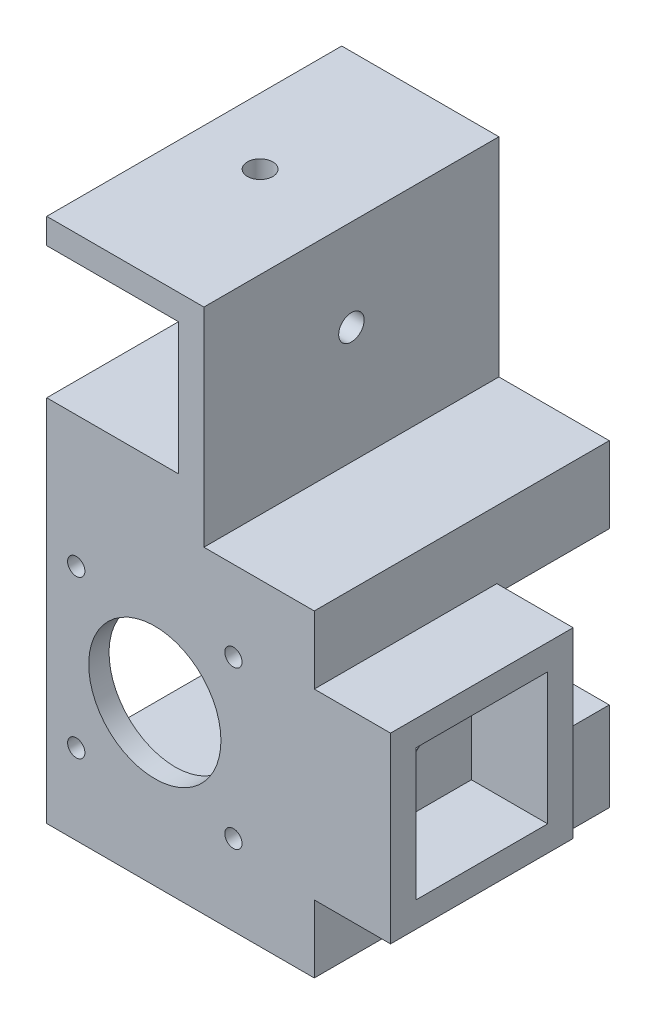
SolidWorks part; units mm, degrees
ref_plane "Front Plane" through (0, 0, 0) normal (0, 0, 1) x (1, 0, 0)
ref_plane "Top Plane" through (0, 0, 0) normal (0, 1, 0) x (1, 0, 0)
ref_plane "Right Plane" through (0, 0, 0) normal (1, 0, 0) x (0, 0, -1)
sketch "Sketch2" plane through (0, 0, 0) normal (0, 0, 1) x (1, 0, 0)
  line L1 (-21.25, -21.25) -> (21.25, -21.25)
  line L2 (-21.25, -21.25) -> (-21.25, 21.25)
  line L3 (-21.25, 21.25) -> (21.25, 21.25)
  line L4 (21.25, -21.25) -> (21.25, 21.25)
  line L5 (-21.25, -21.25) -> (21.25, 21.25) construction
  line L6 (-21.25, 21.25) -> (21.25, -21.25) construction
  line L7 (-31.25, -31.25) -> (31.25, -31.25)
  line L8 (-31.25, -31.25) -> (-31.25, 31.25)
  line L9 (-31.25, 31.25) -> (31.25, 31.25)
  line L10 (31.25, -31.25) -> (31.25, 31.25)
  line L11 (-31.25, -31.25) -> (31.25, 31.25) construction
  line L12 (-31.25, 31.25) -> (31.25, -31.25) construction
  point P0 (0, 0)
  point P6 (0, 0)
  dimension "D1" = 42.5
  dimension "D2" = 42.5
  dimension "D3" = 10
  dimension "D4" = 10
extrude "Boss-Extrude2" add sketch "Sketch2" against normal blind 48
sketch "Sketch3" plane through (0, 0, 0) normal (0, 0, 1) x (1, 0, 0)
  line L0 (31.25, -31.25) -> (31.25, 31.25) construction
  line L1 (-31.25, -31.25) -> (31.25, -31.25)
  line L2 (-31.25, -31.25) -> (-31.25, 31.25)
  line L3 (-31.25, 31.25) -> (31.25, 31.25)
  line L4 (31.25, -31.25) -> (31.25, 31.25)
  line L5 (-31.25, -31.25) -> (31.25, 31.25) construction
  line L6 (-31.25, 31.25) -> (31.25, -31.25) construction
  circle A0 centre (0, 0) radius 13
extrude "Boss-Extrude3" add sketch "Sketch3" along normal blind 10
sketch "Sketch15" plane through (31.25, 0, 0) normal (1, 0, 0) x (0, 0, -1)
  line L0 (19, 31.25) -> (19, -32.891) construction
  line L1 (48, 31.25) -> (-10, 31.25) construction
  line L2 (-10, 0) -> (56.8833, 0) construction
  line L3 (-10, -31.25) -> (-10, 31.25) construction
  line L5 (-10, -31.25) -> (48, -31.25)
  line L6 (-10, -31.25) -> (-10, 31.25)
  line L7 (-10, 31.25) -> (48, 31.25)
  line L8 (48, -31.25) -> (48, 31.25)
  line L9 (-10, -31.25) -> (48, 31.25) construction
  line L10 (-10, 31.25) -> (48, -31.25) construction
  point P9 (19, 0)
extrude "Boss-Extrude8" add sketch "Sketch15" along normal blind 0.1
sketch "Sketch16" plane through (31.35, 0, 0) normal (1, 0, 0) x (0, 0, -1)
  line L0 (19, 31.25) -> (19, 12.95) construction
  line L1 (48, 31.25) -> (-10, 31.25) construction
  line L2 (-10, 0) -> (-5, 0) construction
  line L3 (-10, 31.25) -> (-10, -31.25) construction
  line L5 (-5, -12.95) -> (20.9, -12.95)
  line L6 (-5, -12.95) -> (-5, 12.95)
  line L7 (-5, 12.95) -> (20.9, 12.95)
  line L8 (20.9, -12.95) -> (20.9, 12.95)
  line L11 (-10, -17.95) -> (25.9, -17.95)
  line L12 (-10, -17.95) -> (-10, 17.95)
  line L13 (-10, 17.95) -> (25.9, 17.95)
  line L14 (25.9, -17.95) -> (25.9, 17.95)
  line L17 (19, -12.95) -> (19, -34.4013) construction
  line L19 (20.9, 0) -> (53.4432, 0) construction
  point P9 (19, 0)
  point P14 (19, 0)
  dimension "D1" = 25.9
  dimension "D2" = 25.9
  dimension "D3" = 35.9
  dimension "D4" = 35.9
  dimension "D5" = 0
  dimension "D6" = 5
extrude "Boss-Extrude9" add sketch "Sketch16" along normal blind 20
sketch "Sketch17" plane through (31.35, 0, 0) normal (1, 0, 0) x (0, 0, -1)
  line L0 (7.95, 12.95) -> (7.95, -15.2055) construction
  line L2 (20.9, 12.95) -> (-5, 12.95) construction
  line L4 (-5, 0) -> (31.4158, 0) construction
  line L5 (-5, 12.95) -> (-5, -12.95) construction
  circle A1 centre (7.95, 0) radius 3.43
  dimension "D1" = 6.86
extrude "Cut-Extrude2" cut sketch "Sketch17" against normal blind 10
sketch "Sketch18" plane through (21.25, 0, 0) normal (-1, 0, 0) x (0, 0, 1)
  circle A0 centre (-7.95, 0) radius 7
  dimension "D1" = 14
extrude "Cut-Extrude3" cut sketch "Sketch18" against normal blind 10
sketch "Sketch19" plane through (0, 0, 10) normal (0, 0, 1) x (1, 0, 0)
  line L0 (21.25, 21.25) -> (-21.25, 21.25) construction
  line L1 (-21.25, 21.25) -> (-21.25, -21.25) construction
  line L2 (21.25, -21.25) -> (21.25, 21.25) construction
  line L3 (-21.25, -21.25) -> (21.25, -21.25) construction
  circle A0 centre (-15.45, 15.45) radius 1.7
  circle A1 centre (15.45, 15.45) radius 1.7
  circle A2 centre (15.45, -15.45) radius 1.7
  circle A3 centre (-15.45, -15.45) radius 1.7
  dimension "D1" = 3.4
  dimension "D2" = 3.4
  dimension "D3" = 3.4
  dimension "D4" = 3.4
  dimension "D5" = 5.8
  dimension "D6" = 5.8
  dimension "D7" = 5.8
  dimension "D8" = 5.8
  dimension "D9" = 5.8
  dimension "D10" = 5.8
  dimension "D11" = 5.8
  dimension "D12" = 5.8
extrude "Cut-Extrude4" cut sketch "Sketch19" against normal blind 10
sketch "Sketch20" plane through (0, 31.25, 0) normal (0, 1, 0) x (1, 0, 0)
  line L2 (-31.25, 48) -> (-31.25, -10)
  line L6 (-31.25, 48) -> (9.65, 48)
  line L7 (31.35, 48) -> (-31.25, 48) construction
  line L8 (9.65, 48) -> (9.65, -10)
  line L9 (31.35, -10) -> (-31.25, -10) construction
  line L10 (9.65, -10) -> (-31.25, -10)
  dimension "D1" = 40.9
extrude "Boss-Extrude10" add sketch "Sketch20" along normal blind 45.9
sketch "Sketch24" plane through (0, 0, 10) normal (0, 0, 1) x (1, 0, 0)
  line L0 (9.65, 54.2) -> (-26.25, 54.2) construction
  line L1 (9.65, 77.15) -> (9.65, 31.25) construction
  line L2 (-31.25, 77.15) -> (-31.25, -31.25) construction
  line L4 (-21.25, 72.15) -> (9.65, 72.15)
  line L5 (-21.25, 67.15) -> (4.65, 67.15)
  line L6 (-21.25, 67.15) -> (-21.25, 41.25)
  line L7 (-21.25, 41.25) -> (4.65, 41.25)
  line L8 (4.65, 67.15) -> (4.65, 41.25)
  line L9 (-21.25, 67.15) -> (4.65, 41.25) construction
  line L10 (-21.25, 41.25) -> (4.65, 67.15) construction
  line L12 (-31.25, 72.15) -> (-31.25, 36.25)
  line L17 (-21.25, 67.15) -> (4.65, 41.25) construction
  line L18 (-21.25, 41.25) -> (4.65, 67.15) construction
  line L19 (-21.25, 67.15) -> (-21.25, 41.25)
  line L20 (-21.25, 36.25) -> (9.65, 36.25)
  line L21 (9.65, 72.15) -> (9.65, 36.25)
  line L22 (-21.25, 67.15) -> (9.65, 36.25) construction
  line L23 (-21.25, 41.25) -> (9.65, 72.15) construction
  line L24 (-21.25, 67.15) -> (-21.25, 72.15)
  line L25 (-21.25, 72.15) -> (-21.25, 36.25)
  line L26 (-31.25, 54.2) -> (-34.3237, 54.2) construction
  point P6 (-8.3, 54.2)
  point P7 (-8.3, 54.2)
  point P8 (-8.3, 54.2)
  dimension "D1" = 25.9
  dimension "D2" = 35.9
  dimension "D3" = 10
extrude "Boss-Extrude12" add sketch "Sketch24" along normal blind 20
sketch "Sketch25" plane through (0, 77.15, 0) normal (0, 1, 0) x (1, 0, 0)
  line L1 (-31.25, 48) -> (-31.25, -10) construction
  line L2 (9.65, 48) -> (-31.25, 48)
  line L3 (9.65, 48) -> (9.65, 19)
  line L4 (9.65, 19) -> (-31.25, 19)
  line L5 (-31.25, 48) -> (-31.25, 19)
  dimension "D1" = 29
extrude "Cut-Extrude5" [suppressed] cut sketch "Sketch25" against normal blind 45.9
sketch "Sketch26" plane through (0, 0, 10) normal (0, 0, 1) x (1, 0, 0)
  line L0 (4.65, 54.2) -> (-33.9334, 54.2) construction
  line L1 (4.65, 67.15) -> (4.65, 41.25) construction
  line L2 (-8.3, 67.15) -> (-8.3, 33.0217) construction
  line L3 (-21.25, 67.15) -> (4.65, 67.15) construction
  circle A0 centre (-8.3, 54.2) radius 2.54
  dimension "D1" = 5.08
sketch "Sketch28" [suppressed] plane through (0, 0, -48) normal (0, 0, -1) x (-1, 0, 0)
  line L1 (31.25, -31.25) -> (-31.35, -31.25) construction
  line L2 (21.25, -31.25) -> (21.25, 77.15)
  line L3 (31.25, 77.15) -> (-9.65, 77.15) construction
  line L4 (21.25, 77.15) -> (31.25, 77.15)
  line L5 (31.25, 77.15) -> (31.25, -31.25)
  line L6 (31.25, -31.25) -> (21.25, -31.25)
extrude "Cut-Extrude8" [suppressed] cut sketch "Sketch28" against normal through all
sketch "Sketch35" plane through (31.35, 0, 0) normal (1, 0, 0) x (0, 0, -1)
  line L1 (25.9, -13.75) -> (48, -13.75)
  line L2 (25.9, -13.75) -> (25.9, 16.25)
  line L3 (25.9, 16.25) -> (48, 16.25)
  line L4 (48, -13.75) -> (48, 16.25)
  line L6 (25.9, -17.95) -> (25.9, 17.95) construction
  line L7 (-10, -31.25) -> (48, -31.25) construction
  line L8 (48, -31.25) -> (48, 31.25) construction
  dimension "D1" = 30
  dimension "D2" = 17.5
extrude "Cut-Extrude11" cut sketch "Sketch35" against normal through all
sketch "Sketch37" plane through (0, 0, 10) normal (0, 0, 1) x (1, 0, 0)
  line L1 (4.65, 67.15) -> (-21.25, 67.15)
  line L2 (4.65, 67.15) -> (4.65, 41.25)
  line L3 (4.65, 41.25) -> (-21.25, 41.25)
  line L4 (-21.25, 67.15) -> (-21.25, 41.25)
extrude "Cut-Extrude12" cut sketch "Sketch37" against normal through all
sketch "Sketch38" plane through (0, 0, 10) normal (0, 0, 1) x (1, 0, 0)
  line L0 (9.65, 72.15) -> (9.65, 77.15)
  line L1 (9.65, 77.15) -> (-31.25, 77.15)
  line L2 (-31.25, 77.15) -> (-31.25, -31.25)
  line L3 (9.65, 72.15) -> (-21.25, 72.15)
  line L4 (-21.25, 72.15) -> (-21.25, -31.25)
  line L5 (-31.25, -31.25) -> (31.35, -31.25) construction
  line L6 (-21.25, -31.25) -> (-31.25, -31.25)
extrude "Cut-Extrude13" cut sketch "Sketch38" against normal through all
sketch "Sketch39" plane through (0, 72.15, 0) normal (0, 1, 0) x (1, 0, 0)
  line L1 (-21.25, -30) -> (9.65, -30)
  line L2 (-21.25, -30) -> (-21.25, -10)
  line L3 (-21.25, -10) -> (9.65, -10)
  line L4 (9.65, -30) -> (9.65, -10)
extrude "Cut-Extrude14" cut sketch "Sketch39" against normal through all
sketch "Sketch40" plane through (9.65, 0, 0) normal (1, 0, 0) x (0, 0, -1)
  line L0 (19, 41.25) -> (19, 81.9664) construction
  line L1 (-10, 41.25) -> (48, 41.25) construction
  line L3 (-10, 54.2) -> (55.5773, 54.2) construction
  line L4 (-10, 72.15) -> (-10, 31.25) construction
  circle A0 centre (19, 54.2) radius 2.5
  dimension "D2" = 5
  dimension "D1" = 12.95
extrude "Cut-Extrude15" cut sketch "Sketch40" against normal through all
sketch "Sketch41" plane through (0, 72.15, 0) normal (0, 1, 0) x (1, 0, 0)
  line L0 (-8.3, 48) -> (-8.3, -14.2103) construction
  line L1 (-21.25, 48) -> (9.65, 48) construction
  line L3 (-21.25, -10) -> (-21.25, 48) construction
  circle A0 centre (-8.3, 19) radius 2.5
  dimension "D3" = 5
  dimension "D1" = 12.95
  dimension "D2" = 29
extrude "Cut-Extrude16" cut sketch "Sketch41" against normal blind 10
sketch "Sketch42" plane through (0, 17.95, 0) normal (0, 1, 0) x (1, 0, 0)
  line L0 (51.35, 25.9) -> (51.35, -10)
  line L4 (51.35, -10) -> (46.35, -10)
  line L5 (51.35, -10) -> (31.35, -10) construction
  line L6 (46.35, -10) -> (46.35, 25.9)
  line L7 (51.35, 25.9) -> (31.35, 25.9) construction
  line L8 (46.35, 25.9) -> (51.35, 25.9)
  dimension "D1" = 5
extrude "Cut-Extrude17" cut sketch "Sketch42" against normal through all
ref_plane "Plane1" through (46.35, -17.95, 10) normal (0, 1, 0) x (1, 0, 0)
sketch "Sketch46" plane through (-21.25, 0, 0) normal (-1, 0, 0) x (0, 0, 1)
  line L5 (-48, -21.25) -> (0, -21.25) construction
  line L6 (0, 21.25) -> (6, 21.25)
  line L7 (0, 21.25) -> (0, -21.25)
  line L8 (0, -21.25) -> (6, -21.25)
  line L9 (6, 21.25) -> (6, -21.25)
  dimension "D1" = 0
  dimension "D2" = 6
extrude "Cut-Extrude19" cut sketch "Sketch46" against normal blind 42.5
